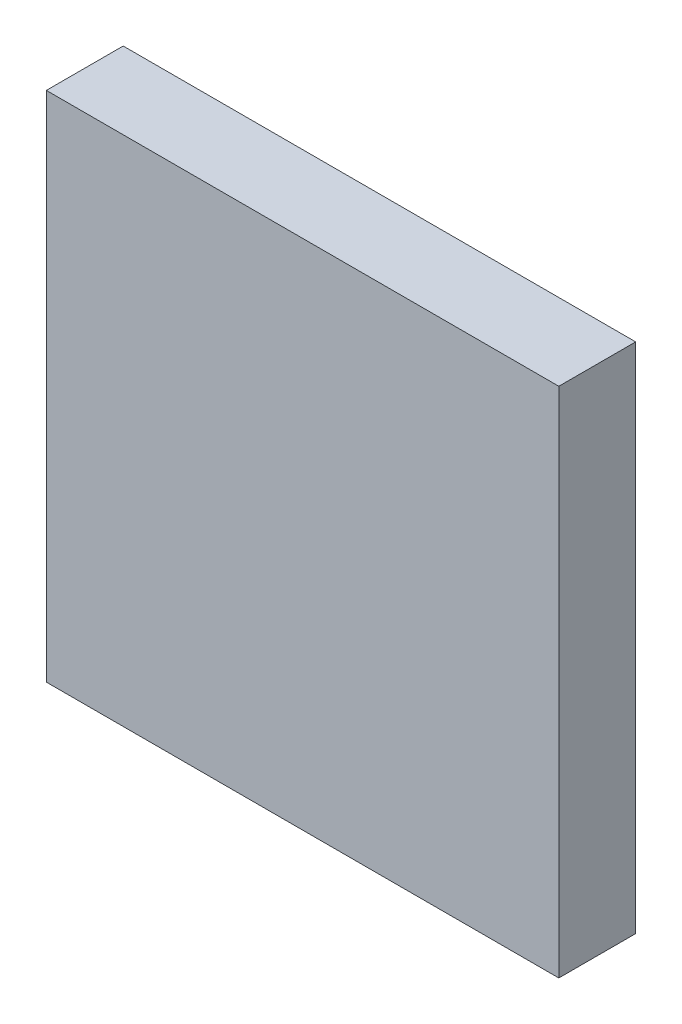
SolidWorks part; units mm, degrees
ref_plane "FRONT" through (0, 0, 0) normal (0, 0, 1) x (1, 0, 0)
ref_plane "TOP" through (0, 0, 0) normal (0, 1, 0) x (1, 0, 0)
ref_plane "RIGHT" through (0, 0, 0) normal (1, 0, 0) x (0, 0, -1)
sketch "Sketch1" plane through (0, 0, 0) normal (0, 0, 1) x (1, 0, 0)
  line L1 (-15.875, 15.875) -> (15.875, 15.875)
  line L2 (-15.875, 15.875) -> (-15.875, -15.875)
  line L3 (-15.875, -15.875) -> (15.875, -15.875)
  line L4 (15.875, 15.875) -> (15.875, -15.875)
  line L5 (-15.875, 15.875) -> (15.875, -15.875) construction
  line L6 (-15.875, -15.875) -> (15.875, 15.875) construction
  point P0 (0, 0)
  dimension "D1" = 31.75
  dimension "D2" = 31.75
extrude "Extrude1" add sketch "Sketch1" along normal blind 4.7625
